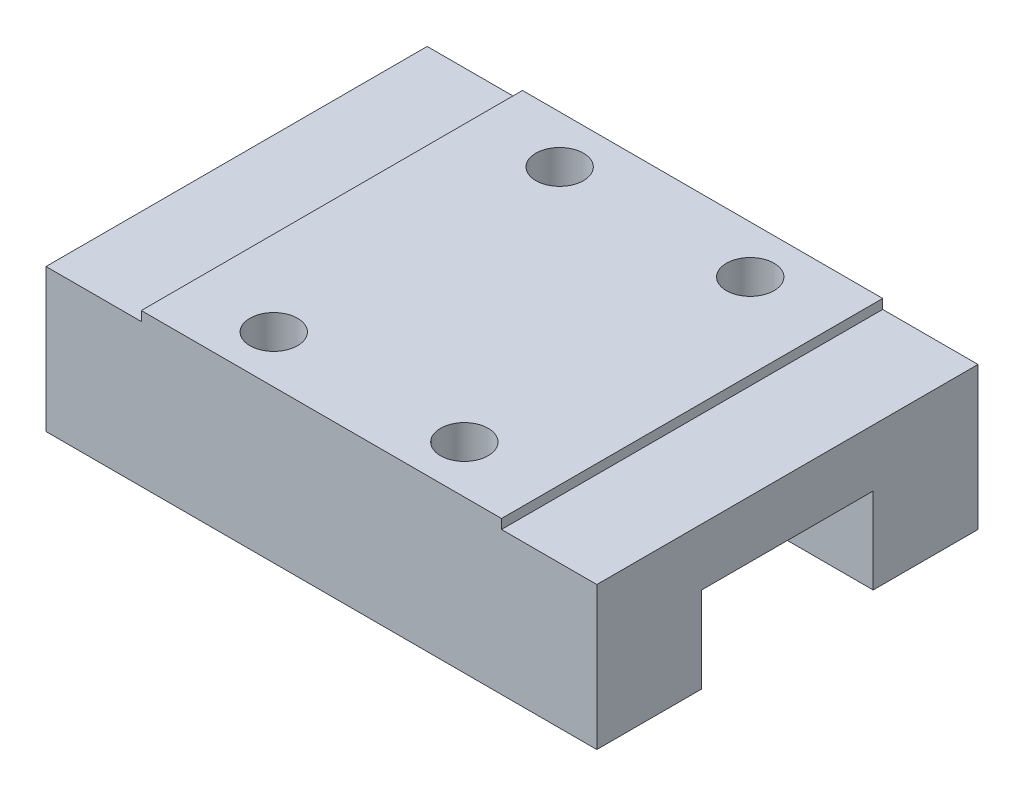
SolidWorks part; units mm, degrees
ref_plane "前视基准面" through (0, 0, 0) normal (0, 0, 1) x (1, 0, 0)
ref_plane "上视基准面" through (0, 0, 0) normal (0, 1, 0) x (1, 0, 0)
ref_plane "右视基准面" through (0, 0, 0) normal (1, 0, 0) x (0, 0, -1)
sketch "草图1" plane through (0, 0, 0) normal (0, 0, 1) x (1, 0, 0)
  line L0 (23.9, 7.5) -> (28.9, 7.5)
  line L1 (0, 7.5) -> (5, 7.5)
  line L2 (5, 7.5) -> (5, 8)
  line L3 (23.9, 7.5) -> (23.9, 8)
  line L4 (0, 0) -> (0, 7.5)
  line L5 (28.9, 0) -> (28.9, 7.5)
  line L6 (5, 8) -> (23.9, 8)
  line L7 (0, 0) -> (28.9, 0)
extrude "凸台-拉伸1" add sketch "草图1" along normal blind 20
sketch "草图2" plane through (28.9, 0, 0) normal (1, 0, 0) x (0, 0, -1)
  line L0 (-14.5, -2) -> (-14.5, 4.5)
  line L1 (-5.5, -2) -> (-5.5, 4.5)
  line L2 (-14.5, -2) -> (-5.5, -2)
  line L3 (-14.5, 4.5) -> (-5.5, 4.5)
extrude "切除-拉伸1" cut sketch "草图2" against normal through all
sketch "草图3" plane through (0, 8, 0) normal (0, 1, 0) x (1, 0, 0)
  circle A0 centre (9.45, -2.5) radius 1.25
  circle A1 centre (9.45, -17.5) radius 1.25
  circle A2 centre (19.45, -17.5) radius 1.25
  circle A3 centre (19.45, -2.5) radius 1.25
extrude "切除-拉伸2" cut sketch "草图3" against normal blind 10
